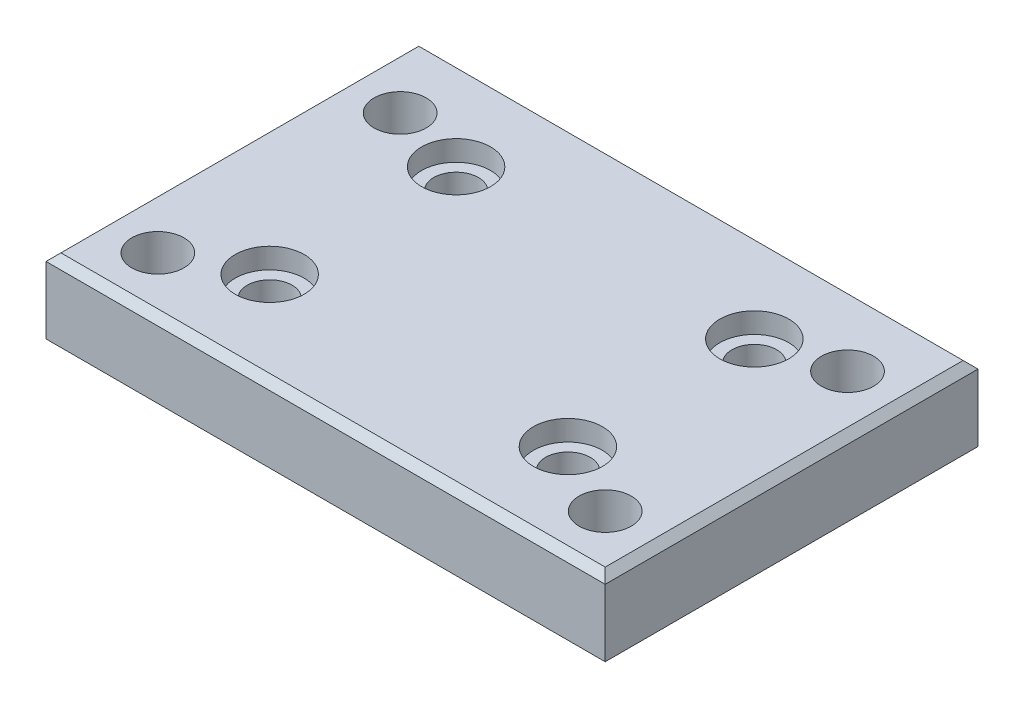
SolidWorks part; units mm, degrees
ref_plane "Front" through (0, 0, 0) normal (0, 0, 1) x (1, 0, 0)
ref_plane "Top" through (0, 0, 0) normal (0, 1, 0) x (1, 0, 0)
ref_plane "Right" through (0, 0, 0) normal (1, 0, 0) x (0, 0, -1)
sketch "Sketch1" plane through (0, 0, 0) normal (0, 1, 0) x (1, 0, 0)
  line L0 (75, -50) -> (-75, 50) construction
  line L1 (-75, 50) -> (75, 50)
  line L2 (-75, 50) -> (-75, -50)
  line L3 (-75, -50) -> (75, -50)
  line L4 (75, 50) -> (75, -50)
  dimension "D1" = 150
  dimension "D2" = 100
extrude "Extrude1" add sketch "Sketch1" along normal blind 20
chamfer "Chamfer1" distance 2 angle 45
hole_wizard "CBORE for M10 SBHCS1" positions "Sketch4" profile "Sketch3" counterbore size "M10" standard "Ansi Metric"
sketch "Sketch4" plane through (0, 20, 0) normal (0, 1, 0) x (-1, 0, 0)
  line L0 (-75, 50) -> (75, 50) construction
  line L2 (75, 50) -> (75, -50) construction
  point P0 (40, 25)
  dimension "D1" = 25
  dimension "D2" = 35
sketch "Sketch3" plane through (-40, 20, 25) normal (1, 0, 0) x (0, 0, 1)
  line L0 (0, 0) -> (0, 20)
  line L1 (0, 20) -> (6, 20)
  line L3 (6, 20) -> (6, 5.5)
  line L4 (6, 5.5) -> (9.25, 5.5)
  line L5 (9.25, 5.5) -> (9.25, 0)
  line L7 (9.25, 0) -> (0, 0)
  line L11 (0, -6.35) -> (0, 107.95) construction
  dimension "Thru Hole Dia." = 12
  dimension "Thru Hole Depth" = 20
  dimension "C'Bore Dia." = 18.5
  dimension "C'Bore Depth" = 5.5
pattern_linear "LPattern2" count 2 spacing 80 count 2 spacing 50
hole_wizard "M16x2.0 Tapped Hole1" positions "Sketch8" profile "Sketch7" tap size "M16x2.0" standard "Ansi Metric"
sketch "Sketch8" plane through (0, 20, 0) normal (0, 1, 0) x (-1, 0, 0)
  line L0 (75, 50) -> (75, -50) construction
  line L1 (-75, 50) -> (75, 50) construction
  point P0 (60, 35)
  dimension "D1" = 15
  dimension "D2" = 15
sketch "Sketch7" plane through (-60, 20, 35) normal (1, 0, 0) x (0, 0, 1)
  line L0 (0, 0) -> (0, 20)
  line L1 (0, 20) -> (7, 20)
  line L2 (7, 20) -> (7, 0)
  line L5 (7, 0) -> (0, 0)
  line L11 (0, -6.35) -> (0, 107.95) construction
  dimension "Thru Tap Drill Dia." = 14
  dimension "Thru Tap Drill Depth" = 20
pattern_linear "LPattern3" count 2 spacing 65 count 2 spacing 120
